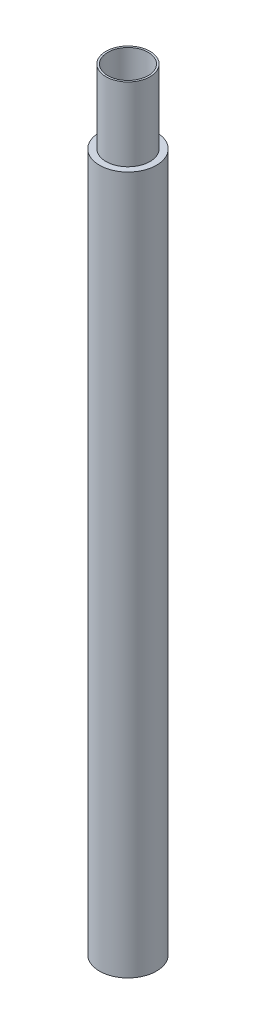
SolidWorks part; units mm, degrees
ref_plane "Plan de face" through (0, 0, 0) normal (0, 0, 1) x (1, 0, 0)
ref_plane "Plan de dessus" through (0, 0, 0) normal (0, 1, 0) x (1, 0, 0)
ref_plane "Plan de droite" through (0, 0, 0) normal (1, 0, 0) x (0, 0, -1)
sketch "Esquisse1" plane through (0, 0, 0) normal (0, 0, 1) x (1, 0, 0)
  line L0 (70, 1150) -> (70, -950)
  line L1 (70, -950) -> (-7.5, -950)
  line L3 (10, 950) -> (-7.5, 950)
  line L4 (-7.5, -950) -> (-7.5, 950)
  line L7 (70, 1150) -> (10, 1150)
  line L8 (10, 950) -> (10, 1150)
  point P0 (0, 0)
  dimension "D1" = 77.5
  dimension "D2" = 1900
  dimension "D3" = 60
revolve "Révolution1" add sketch "Esquisse1" angle 360 about L0
shell "Coque1" thickness 5
sketch "Esquisse2" plane through (0, -950, 0) normal (0, -1, 0) x (-1, 0, 0)
  circle A0 centre (-70, 0) radius 72.5
  circle A1 centre (-70, 0) radius 77.5 construction
  dimension "D1" = 5
extrude "Enlèv. mat.-Extru.1" cut sketch "Esquisse2" against normal blind 10
